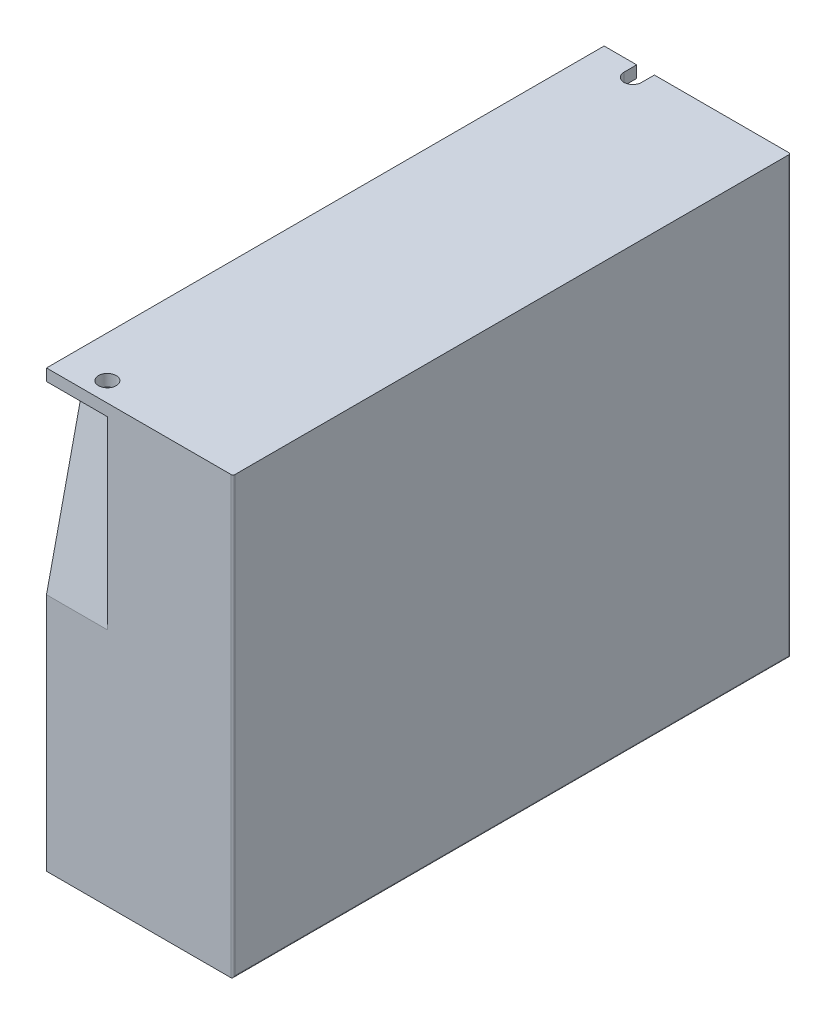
SolidWorks part; units mm, degrees
ref_plane "前视基准面" through (0, 0, 0) normal (0, 0, 1) x (1, 0, 0)
ref_plane "上视基准面" through (0, 0, 0) normal (0, 1, 0) x (1, 0, 0)
ref_plane "右视基准面" through (0, 0, 0) normal (1, 0, 0) x (0, 0, -1)
sketch "草图1" plane through (0, 0, 0) normal (1, 0, 0) x (0, 0, -1)
  line L1 (-71, -55.5) -> (71, -55.5)
  line L2 (-71, -55.5) -> (-71, 55.5)
  line L3 (-71, 55.5) -> (71, 55.5)
  line L4 (71, -55.5) -> (71, 55.5)
  line L5 (-71, -55.5) -> (71, 55.5) construction
  line L6 (-71, 55.5) -> (71, -55.5) construction
  point P0 (0, 0)
extrude "凸台-拉伸1" add sketch "草图1" along normal blind 47.5
sketch "草图3" plane through (0, 0, 0) normal (-1, 0, 0) x (0, 0, 1)
  line L1 (71, 55.5) -> (71, -55.5) construction
  line L2 (71, 52.5) -> (60.5, 52.5)
  line L3 (71, 52.5) -> (71, 5.5)
  line L4 (60.5, 52.5) -> (71, 5.5)
  line L5 (-71, 52.5) -> (-71, 5.5)
  line L6 (-71, -55.5) -> (-71, 55.5) construction
  line L7 (-71, 52.5) -> (-60.5, 52.5)
  line L8 (-71, 5.5) -> (-60.5, 52.5)
extrude "切除-拉伸1" cut sketch "草图3" against normal blind 15.5
sketch "草图4" plane through (0, 55.5, 0) normal (0, 1, 0) x (1, 0, 0)
  line L3 (8.3, 67.75) -> (8.3, 71)
  line L4 (47.5, 71) -> (0, 71) construction
  line L6 (8.3, 71) -> (12.8, 71)
  line L7 (12.8, 71) -> (12.8, 67.75)
  circle A0 centre (10.55, -66.05) radius 2.25
  arc A1 (8.3, 67.75) -> (12.8, 67.75) centre (10.55, 67.75) ccw
extrude "切除-拉伸2" cut sketch "草图4" against normal blind 3
fillet "圆角1" radius 0.5 3 edges at (47.5, 0, -71) (47.5, 0, 71) (47.5, -55.5, 0)
sketch "草图5" plane through (47.5, 0, 0) normal (1, 0, 0) x (0, 0, -1)
  text T0 "MA-2" font "汉仪长仿宋体" height 10
